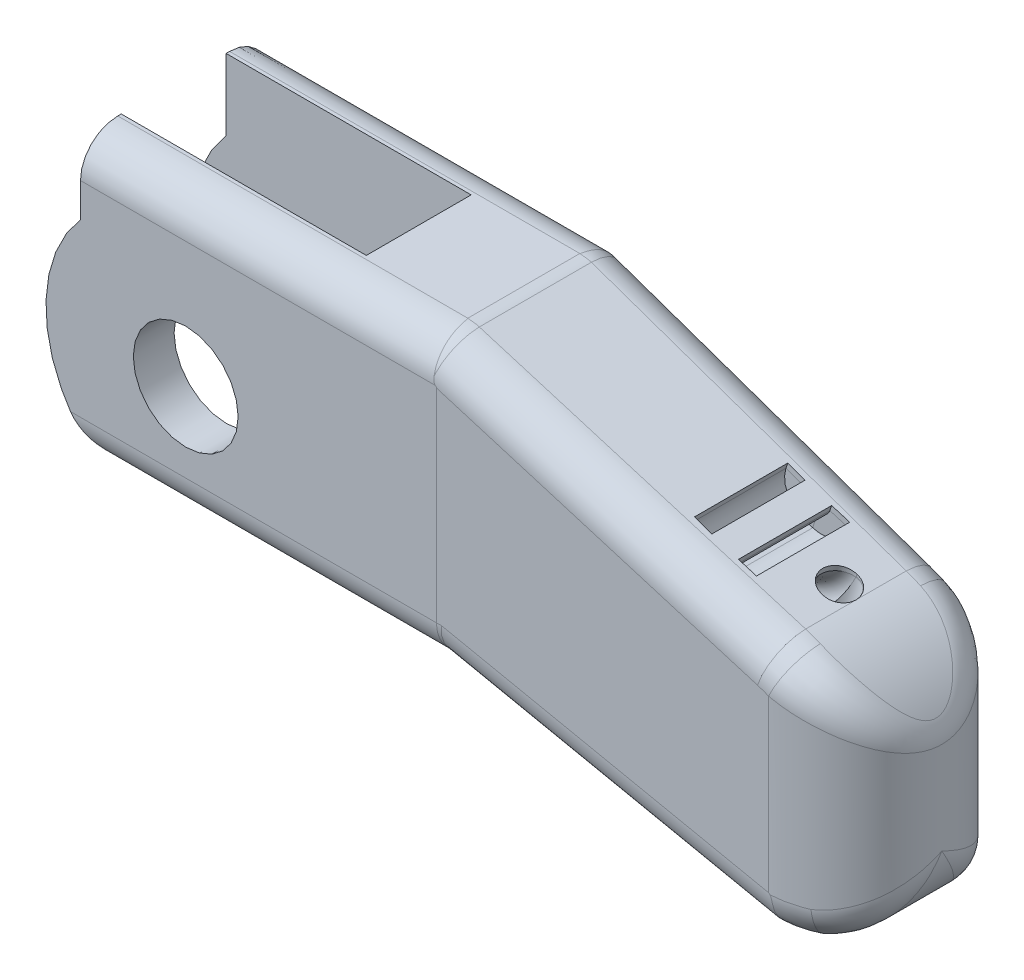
SolidWorks part; units mm, degrees
ref_plane "Front Plane" through (0, 0, 0) normal (0, 0, 1) x (1, 0, 0)
ref_plane "Top Plane" through (0, 0, 0) normal (0, 1, 0) x (1, 0, 0)
ref_plane "Right Plane" through (0, 0, 0) normal (1, 0, 0) x (0, 0, -1)
sketch "Sketch1" plane through (0, 0, 0) normal (0, 1, 0) x (1, 0, 0)
  line L0 (22.352, 12.7) -> (44.577, 12.3031)
  line L1 (0, 0) -> (22.352, 0)
  line L2 (0, 0) -> (0, 12.7)
  line L3 (0, 12.7) -> (22.352, 12.7)
  line L5 (44.577, 0.3969) -> (22.352, 0)
  arc A0 (44.577, 12.3031) -> (44.577, 0.3969) centre (44.4707, 6.35) cw
  point P9 (0, 6.35)
  dimension "D1" = 12.7
  dimension "D2" = 11.9062
  dimension "D3" = 22.352
  dimension "D4" = 22.225
extrude "Boss-Extrude1" add sketch "Sketch1" along normal blind 24.13
sketch "Sketch3" plane through (0, 0, 0) normal (0, 0, 1) x (1, 0, 0)
  line L0 (22.352, 24.13) -> (22.352, 0) construction
  line L1 (0, 0) -> (31.75, 0)
  line L2 (0, 0) -> (0, 5.08)
  line L3 (0, 5.08) -> (22.352, 5.08)
  line L5 (22.352, 5.08) -> (44.577, 0)
  line L6 (44.577, 0) -> (31.75, 0)
  dimension "D1" = 19.05
extrude "Cut-Extrude1" cut sketch "Sketch3" against normal through all
sketch "Sketch4" plane through (0, 0, 0) normal (0, 0, 1) x (1, 0, 0)
  line L0 (22.352, 24.13) -> (44.577, 16.9111)
  line L1 (44.577, 24.13) -> (44.577, 0) construction
  line L2 (50.4248, 0) -> (50.4248, 24.13) construction
  line L3 (50.4248, 11.9883) -> (50.4248, 24.13)
  line L4 (50.4248, 24.13) -> (22.352, 24.13)
  arc A0 (44.577, 16.9111) -> (50.4248, 11.9883) centre (41.4383, 7.248) cw
  dimension "D2" = 10.16
  dimension "D1" = 23.368
extrude "Cut-Extrude2" cut sketch "Sketch4" against normal through all
sketch "Sketch5" plane through (0, 0, 0) normal (0, 0, 1) x (1, 0, 0)
  line L2 (46.1068, 0) -> (50.4248, 0)
  line L3 (50.4248, 0) -> (50.4248, 5.0225)
  arc A0 (50.4248, 5.0225) -> (46.1068, 0) centre (45.3448, 5.0225) cw
  dimension "D1" = 5.08
  dimension "D2" = 4.318
extrude "Cut-Extrude3" cut sketch "Sketch5" against normal through all
sketch "Sketch7" plane through (0, 0, 0) normal (0, 0, 1) x (1, 0, 0)
  line L0 (0, 20.955) -> (0, 5.08)
  line L1 (0, 20.955) -> (0, 24.13)
  line L2 (0, 24.13) -> (22.352, 24.13) construction
  line L3 (0, 24.13) -> (-1.905, 24.13)
  line L4 (-1.905, 24.13) -> (-1.905, 19.2876)
  arc A1 (-1.905, 19.2876) -> (0, 5.08) centre (5.2651, 13.0175) ccw
  dimension "D2" = 19.05
  dimension "D1" = 3.175
  dimension "D3" = 1.905
  dimension "D4" = 4.8424
ref_plane "Plane1" through (0, 0, -6.35) normal (0, 0, 1) x (1, 0, 0)
extrude "Boss-Extrude4" add sketch "Sketch7" against normal up to surface (12.7 mm away)
sketch "Sketch9" plane through (0, 24.13, 0) normal (0, 1, 0) x (1, 0, 0)
  line L0 (-13.9922, 6.35) -> (13.9922, 6.35) construction
  line L5 (-4.2599, 2.7781) -> (14.7901, 2.7781)
  line L6 (-4.2599, 2.7781) -> (-4.2599, 9.9219)
  line L7 (-4.2599, 9.9219) -> (14.7901, 9.9219)
  line L8 (14.7901, 2.7781) -> (14.7901, 9.9219)
  line L11 (-4.2599, 12.7) -> (-4.2599, 0) construction
  point P4 (14.7901, 6.35)
  dimension "D1" = 7.1437
  dimension "D2" = 19.05
extrude "Cut-Extrude5" cut sketch "Sketch9" against normal through all
fillet "Fillet1" radius 2.54 3 edges at (33.4645, 20.5205, -12.5016) (50.3778, 12.0763, -7.0964) (33.4645, 20.5205, -0.1984)
sketch "Sketch10" plane through (0, 0, 0) normal (0, 0, 1) x (1, 0, 0)
  circle A0 centre (5.2651, 13.0175) radius 3.5719
  arc A1 (-1.905, 19.2876) -> (0, 5.08) centre (5.2651, 13.0175) ccw construction
  dimension "D1" = 7.1437
extrude "Cut-Extrude6" cut sketch "Sketch10" against normal through all
sketch "Sketch11" plane through (14.7901, 0, 0) normal (-1, 0, 0) x (0, 0, 1)
  line L0 (-6.35, -13.9922) -> (-6.35, 13.9922) construction
  line L1 (-2.7781, 24.13) -> (-9.9219, 24.13) construction
  circle A0 centre (-6.35, 22.225) radius 1.1906
  dimension "D1" = 2.3813
  dimension ".075" = 1.905
sketch "Sketch12" plane through (0, 0, -6.35) normal (0, 0, 1) x (1, 0, 0)
  line L0 (22.352, 18.2486) -> (14.7901, 21.0344)
  line L1 (44.577, 16.9111) -> (47.2179, 21.5675)
  line L2 (22.352, 21.4741) -> (22.352, 5.08) construction
  line L3 (22.352, 18.2486) -> (36.3298, 13.7084)
  line L5 (43.8377, 14.4953) -> (22.352, 21.4741) construction
  arc A0 (36.3298, 13.7084) -> (44.577, 16.9111) centre (38.4912, 20.3627) ccw
  dimension "D2" = 6.9965
  dimension "D1" = 3.0677
  dimension "D3" = 4.6564
sweep "Cut-Sweep1" cut profiles "Sketch11" path "Sketch12"
sketch "Sketch13" plane through (9.2228, 28.3945, 0) normal (0.3089, 0.9511, 0) x (0.9511, -0.3089, 0)
  line L0 (13.8044, 10.1736) -> (13.8044, 2.5264) construction
  line L1 (32.0926, 9.525) -> (33.3624, 9.5466)
  line L2 (32.0926, 9.525) -> (32.0926, 3.175)
  line L3 (32.0926, 3.175) -> (33.3624, 3.1966)
  line L4 (33.3624, 9.5466) -> (33.3624, 3.1966)
  line L5 (13.8044, 2.5264) -> (37.1724, 2.9233) construction
  line L6 (40.0713, 6.35) -> (31.863, 6.35) construction
  line L8 (37.1724, 6.35) -> (37.1724, 2.9233) construction
  point P8 (33.3624, 6.3716)
  point P11 (13.8044, 6.35)
  point P14 (32.0926, 6.35)
  dimension "D1" = 6.35
  dimension "D2" = 1.27
  dimension "D3" = 3.81
sketch "Sketch14" plane through (0, 0, -6.35) normal (0, 0, 1) x (1, 0, 0)
  line L1 (39.7457, 18.4804) -> (39.628, 18.118)
  line L2 (47.3341, 16.0155) -> (39.5273, 18.5513) construction
  line L3 (38.8278, 17.7102) -> (38.2239, 17.9064)
  line L4 (37.8161, 18.7065) -> (37.9338, 19.0689)
  arc A0 (39.628, 18.118) -> (38.8278, 17.7102) centre (39.024, 18.3142) cw
  arc A1 (38.2239, 17.9064) -> (37.8161, 18.7065) centre (38.4201, 18.5103) cw
  point P9 (39.4318, 17.514)
  point P12 (37.62, 18.1025)
  dimension "D3" = 0.635
  dimension "D1" = 1.905
  dimension "D2" = 1.016
sweep "Cut-Sweep2" cut profiles "Sketch13" path "Sketch14"
sketch "Sketch15" plane through (14.7901, 0, 0) normal (-1, 0, 0) x (0, 0, 1)
  line L0 (-6.35, -13.9922) -> (-6.35, 13.9922) construction
  line L1 (-2.7781, 5.08) -> (-9.9219, 5.08) construction
  circle A0 centre (-6.35, 6.985) radius 1.1906
  dimension "D1" = 2.3812
  dimension "D2" = 1.905
sketch "Sketch16" plane through (0, 0, -6.35) normal (0, 0, 1) x (1, 0, 0)
  line L0 (14.7901, 8.1756) -> (19.8701, 11.5938)
  line L3 (19.8701, 11.5938) -> (22.352, 11.5938)
  line L4 (22.352, 21.4741) -> (22.352, 5.08) construction
  line L5 (22.352, 11.5938) -> (34.7327, 8.7639)
  line L6 (22.352, 5.08) -> (44.577, 0) construction
  line L7 (22.352, 5.08) -> (0, 5.08) construction
  arc A0 (34.7327, 8.7639) -> (39.5081, 1.1586) centre (33.3178, 2.5735) cw
  dimension "D1" = 5.08
  dimension "D2" = 5.0689
  dimension "D3" = 6.35
sweep "Cut-Sweep5" cut profiles "Sketch15" path "Sketch16"
sketch "Sketch17" plane through (2.2133, 9.6831, 0) normal (-0.2228, -0.9749, 0) x (0.9749, -0.2228, 0)
  line L0 (30.7439, -6.35) -> (43.4563, -6.35) construction
  line L1 (33.8043, -3.175) -> (35.0743, -3.175)
  line L2 (33.8043, -3.175) -> (33.8043, -9.525)
  line L3 (33.8043, -9.525) -> (35.0743, -9.525)
  line L4 (35.0743, -3.175) -> (35.0743, -9.525)
  line L5 (13.9922, -6.35) -> (-13.9922, -6.35) construction
  line L6 (43.4563, -12.3031) -> (43.4563, -0.3969) construction
  point P10 (33.8043, -6.35)
  dimension "D1" = 6.35
  dimension "D2" = 1.27
  dimension "D3" = 8.382
sketch "Sketch19" plane through (0, 0, -6.35) normal (0, 0, 1) x (1, 0, 0)
  line L0 (33.3106, 2.5752) -> (33.3955, 2.9466)
  line L1 (32.1842, 2.8326) -> (44.577, 0) construction
  line L2 (34.156, 3.4241) -> (34.775, 3.2827)
  line L3 (35.2526, 2.5221) -> (35.1677, 2.1507)
  arc A0 (34.775, 3.2827) -> (35.2526, 2.5221) centre (34.6335, 2.6636) cw
  arc A1 (33.3955, 2.9466) -> (34.156, 3.4241) centre (34.0145, 2.8051) cw
  point P8 (35.3941, 3.1412)
  point P11 (33.537, 3.5656)
  dimension "D3" = 0.635
  dimension "D1" = 1.016
  dimension "D2" = 1.905
sweep "Cut-Sweep6" cut profiles "Sketch17" path "Sketch19"
fillet "Fillet5" radius 2.54 5 edges at (22.352, 24.13, -6.35) (20.7307, 24.13, -11.7145) (20.7307, 24.13, -0.9855) (7.3006, 24.13, 0) (7.3006, 24.13, -12.7)
fillet "Fillet6" radius 2.54 6 edges at (33.4645, 2.54, -12.5016) (45.3493, 0, -0.4611) (45.3493, 0, -12.2389) (48.961, 1.4547, -10.26) (48.961, 1.4547, -2.44) (33.4645, 2.54, -0.1984)
fillet "Fillet7" radius 2.54 4 edges at (28.0742, 5.08, -12.5978) (11.176, 5.08, -12.7) (28.0742, 5.08, -0.1022) (11.176, 5.08, 0)
sketch "Sketch23" plane through (9.2228, 28.3945, 0) normal (0.3089, 0.9511, 0) x (0.9511, -0.3089, 0)
  line L0 (-13.9922, 6.35) -> (13.9922, 6.35) construction
  line L1 (37.1724, 9.7767) -> (37.1724, 6.35) construction
  circle A0 centre (35.9818, 6.35) radius 1.1906
  dimension "D1" = 2.3813
sketch "Sketch24" plane through (0, 0, -6.35) normal (0, 0, 1) x (1, 0, 0)
  line L0 (44.577, 16.9111) -> (39.508, 1.1588)
  spline S1 degree 3 number of poles 194 (39.508, 1.1587) -> (34.7327, 8.7639) construction
  dimension "D1" = 15.7523
sweep "Cut-Sweep12" cut profiles "Sketch23" path "Sketch24"
